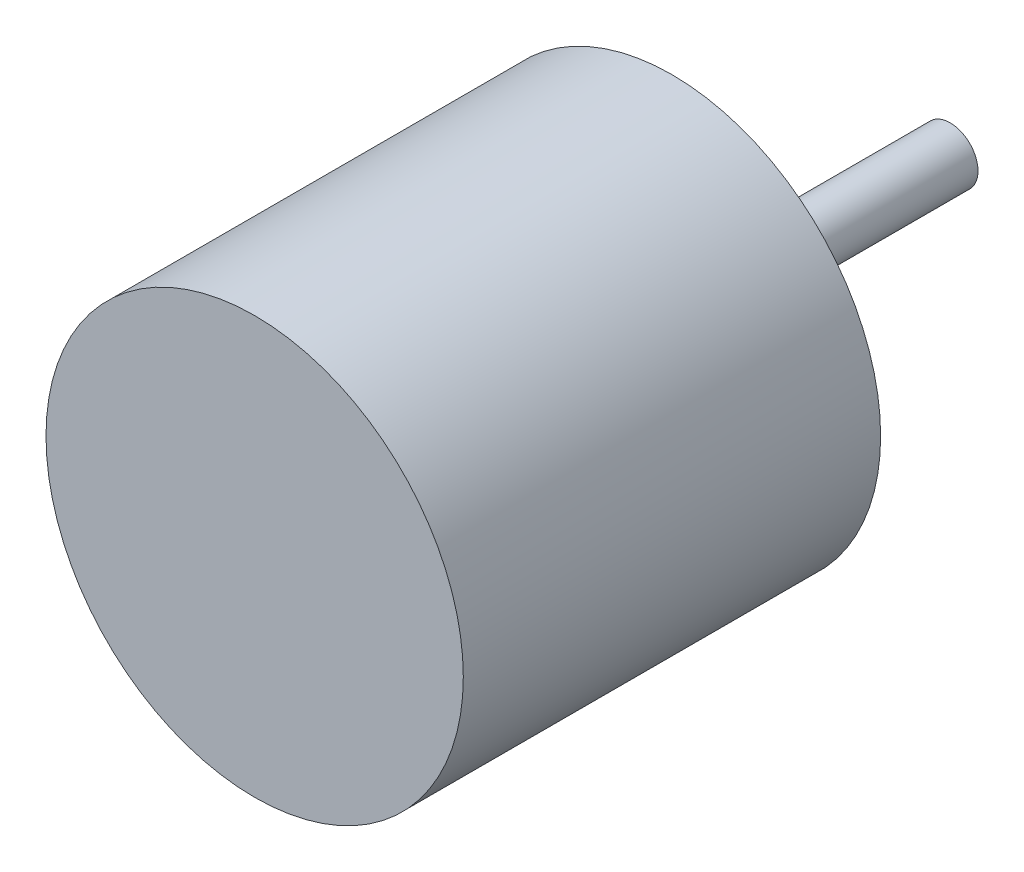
SolidWorks part; units mm, degrees
ref_plane "Face" through (0, 0, 0) normal (0, 0, 1) x (1, 0, 0)
ref_plane "Dessus" through (0, 0, 0) normal (0, 1, 0) x (1, 0, 0)
ref_plane "Droite" through (0, 0, 0) normal (1, 0, 0) x (0, 0, -1)
sketch "Esquisse1" plane through (0, 0, 0) normal (0, 0, 1) x (1, 0, 0)
  circle A0 centre (0, 0) radius 10
  dimension "D1" = 20
extrude "Extrusion1" add sketch "Esquisse1" along normal blind 100
sketch "Esquisse2" plane through (0, 0, 100) normal (0, 0, 1) x (1, 0, 0)
  circle A0 centre (0, 0) radius 75
  dimension "D1" = 150
extrude "Extrusion2" add sketch "Esquisse2" along normal blind 150
